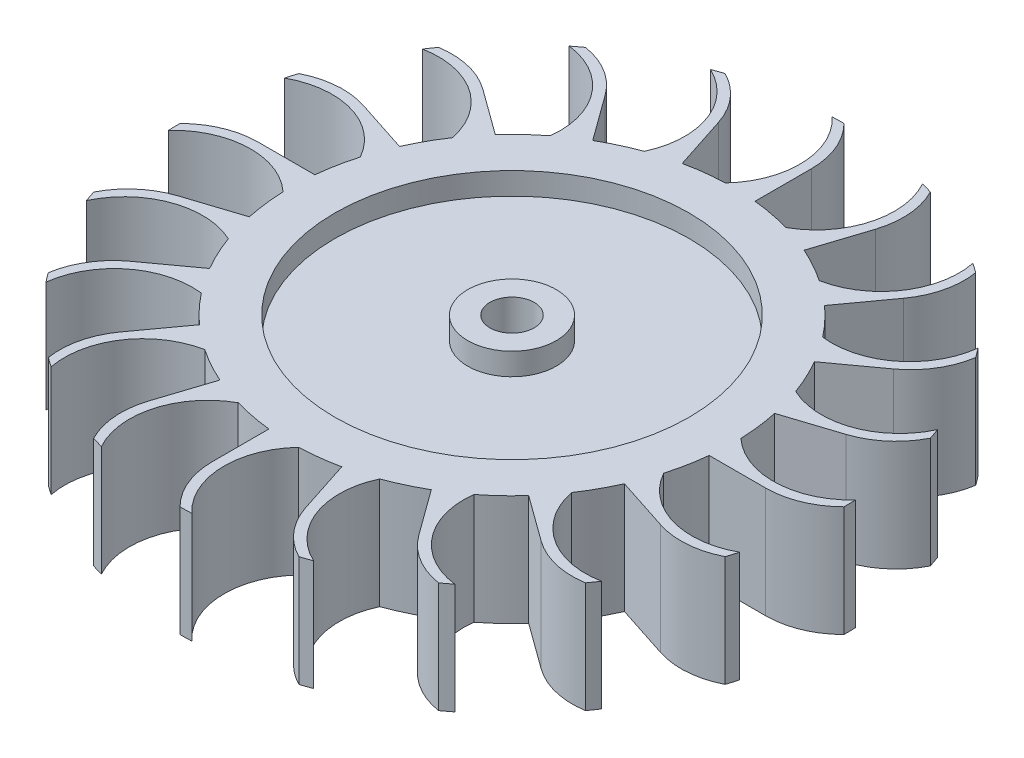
SolidWorks part; units mm, degrees
ref_plane "Front Plane" through (0, 0, 0) normal (0, 0, 1) x (1, 0, 0)
ref_plane "Top Plane" through (0, 0, 0) normal (0, 1, 0) x (1, 0, 0)
ref_plane "Right Plane" through (0, 0, 0) normal (1, 0, 0) x (0, 0, -1)
sketch "Sketch1" plane through (0, 0, 0) normal (0, 1, 0) x (1, 0, 0)
  circle A0 centre (0, 0) radius 5.08
  circle A1 centre (0, 0) radius 50.8
  dimension "D1" = 10.16
  dimension "D2" = 101.6
extrude "Boss-Extrude1" add sketch "Sketch1" along normal blind 25.4
sketch "Sketch2" plane through (0, 0, 0) normal (0, 1, 0) x (1, 0, 0)
  line L0 (5.2605, 63.5) -> (5.2605, 50.5265)
  circle A0 centre (0, 0.0775) radius 50.7225
  arc A1 (0, 50.8) -> (0, 76.2) centre (-12.7, 63.5) ccw
  circle A2 centre (0, 0) radius 50.8 construction
  circle A3 centre (0, 0) radius 50.8
  circle A4 centre (0, 0) radius 50.8
  arc A5 (-1.7727, 50.769) -> (-2.659, 76.1535) centre (-14.9081, 63.0181) ccw
  arc A6 (-2.659, 76.1535) -> (0, 76.2) centre (0, 0.0775) cw
  point P16 (0.0014, 0)
  dimension "D1" = 2
extrude "Boss-Extrude2" add sketch "Sketch2" along normal blind 25.4 contours A6 A5 A3 A1 | A3 L0 A1
pattern_circular "CirPattern1" count 20 every 18 about axis through (0, 0, 0) along (0, 1, 0) of "Boss-Extrude2"
sketch "Sketch3" plane through (0, 25.4, 0) normal (0, 1, 0) x (1, 0, 0)
  circle A0 centre (0, 0) radius 10.16
  circle A1 centre (0, 0) radius 40.64
  arc A2 (50.7691, 1.7726) -> (49.6795, 10.6106) centre (0, 0) ccw construction
  dimension "D1" = 10.16
extrude "Cut-Extrude1" cut sketch "Sketch3" against normal blind 5.08
sketch "Sketch4" plane through (0, 0, 0) normal (0, -1, 0) x (-1, 0, 0)
  circle A0 centre (0, 0) radius 10.16
  circle A1 centre (0, 0) radius 40.64
extrude "Cut-Extrude2" cut sketch "Sketch4" against normal blind 5.08
